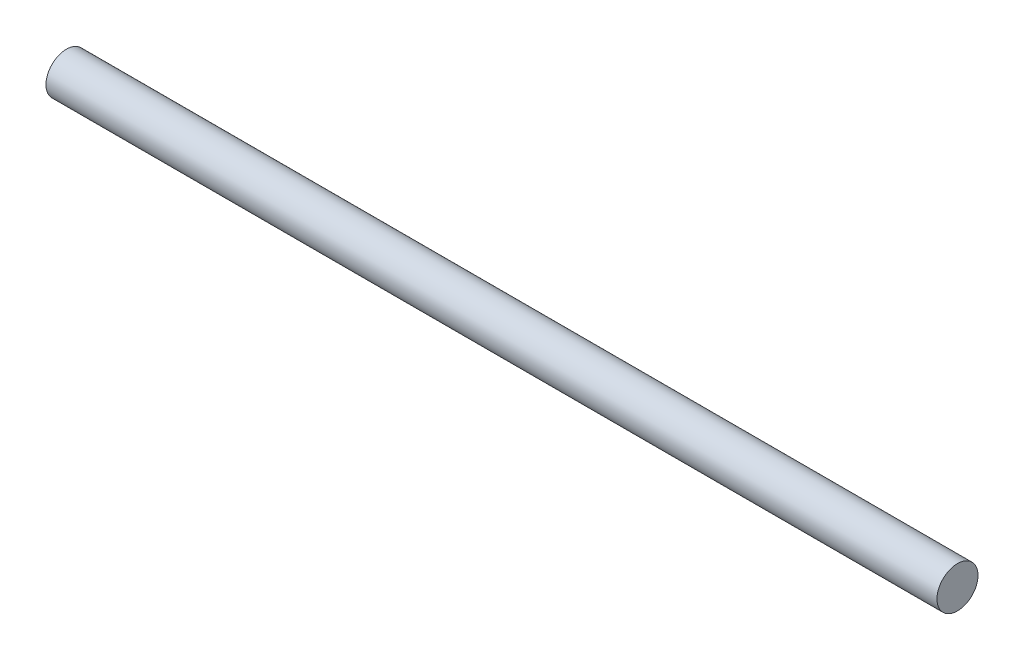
SolidWorks part; units mm, degrees
ref_plane "Front" through (0, 0, 0) normal (0, 0, 1) x (1, 0, 0)
ref_plane "Top" through (0, 0, 0) normal (0, 1, 0) x (1, 0, 0)
ref_plane "Right" through (0, 0, 0) normal (1, 0, 0) x (0, 0, -1)
sketch "Sketch2" plane through (0, 0, 0) normal (1, 0, 0) x (0, 0, -1)
  circle A0 centre (0, 0) radius 2.413
  dimension "D1" = 4.826
extrude "Base-Extrude" add sketch "Sketch2" along normal blind 104.775
